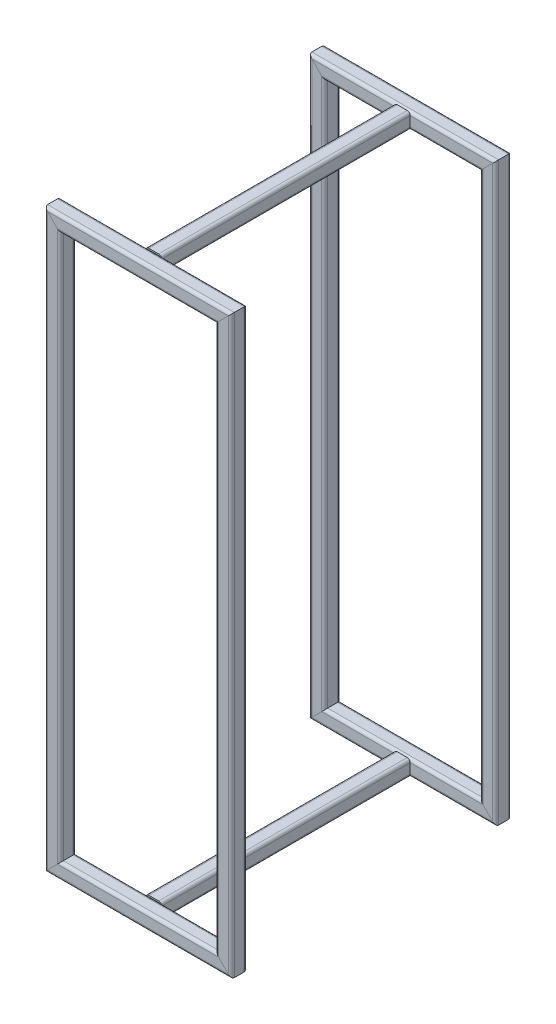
SolidWorks part; units mm, degrees
ref_plane "Front Plane" through (0, 0, 0) normal (0, 0, 1) x (1, 0, 0)
ref_plane "Top Plane" through (0, 0, 0) normal (0, 1, 0) x (1, 0, 0)
ref_plane "Right Plane" through (0, 0, 0) normal (1, 0, 0) x (0, 0, -1)
sketch3d "3DSketch2"
  line L0 (0, 0, 0) -> (0, 1800, 0) construction
  line L1 (274.6, 0, 424.6) -> (274.6, 1800, 424.6)
  line L2 (-274.6, 0, 424.6) -> (-274.6, 1800, 424.6)
  line L3 (0, 1800, -424.6) -> (0, 1800, 424.6)
  line L5 (274.6, 1800, 424.6) -> (-274.6, 1800, 424.6)
  line L7 (274.6, 1800, -424.6) -> (-274.6, 1800, -424.6)
  line L10 (0, 0, -424.6) -> (0, 0, 424.6)
  line L12 (274.6, 0, -424.6) -> (-274.6, 0, -424.6)
  line L14 (274.6, 0, 424.6) -> (-274.6, 0, 424.6)
  line L15 (274.6, 0, -424.6) -> (274.6, 1800, -424.6)
  line L16 (-274.6, 0, -424.6) -> (-274.6, 1800, -424.6)
  point P4 (0, 1800, 0)
  dimension "D1" = 1800
  dimension "D2" = 849.2
  dimension "D3" = 549.2
other "Tube square TS2X2X0.1875(1)"
ref_plane "Plane1" through (274.6, 0, 424.6) normal (0, 1, 0) x (1, 0, 0)
sketch "Sketch1" plane through (274.6, 0, 424.6) normal (0, 1, 0) x (1, 0, 0)
  line L0 (-15.875, -20.6375) -> (15.875, -20.6375)
  line L1 (-20.6375, -15.875) -> (-20.6375, 15.875)
  line L2 (15.875, 20.6375) -> (-15.875, 20.6375)
  line L3 (20.6375, 15.875) -> (20.6375, -15.875)
  line L4 (-15.875, -25.4) -> (15.875, -25.4)
  line L5 (-25.4, -15.875) -> (-25.4, 15.875)
  line L6 (15.875, 25.4) -> (-15.875, 25.4)
  line L7 (25.4, 15.875) -> (25.4, -15.875)
  line L8 (-25.4, 0) -> (-20.6375, 0) construction
  line L9 (-20.6375, 0) -> (20.6375, 0) construction
  line L10 (20.6375, 0) -> (25.4, 0) construction
  line L11 (0, 25.4) -> (0, 20.6375) construction
  line L12 (0, 20.6375) -> (0, -20.6375) construction
  line L13 (0, -20.6375) -> (0, -25.4) construction
  arc A0 (25.4, 15.875) -> (15.875, 25.4) centre (15.875, 15.875) ccw
  arc A1 (15.875, -25.4) -> (25.4, -15.875) centre (15.875, -15.875) ccw
  arc A2 (-25.4, -15.875) -> (-15.875, -25.4) centre (-15.875, -15.875) ccw
  arc A3 (-15.875, 25.4) -> (-25.4, 15.875) centre (-15.875, 15.875) ccw
  arc A4 (-15.875, 20.6375) -> (-20.6375, 15.875) centre (-15.875, 15.875) ccw
  arc A5 (20.6375, 15.875) -> (15.875, 20.6375) centre (15.875, 15.875) ccw
  arc A6 (15.875, -20.6375) -> (20.6375, -15.875) centre (15.875, -15.875) ccw
  arc A7 (-20.6375, -15.875) -> (-15.875, -20.6375) centre (-15.875, -15.875) ccw
  point P6 (-25.4, -25.4)
  point P33 (-25.4, 25.4)
  point P35 (25.4, 25.4)
  point P36 (25.4, -25.4)
  point P37 (0, 0)
  point P38 (0, 0)
  dimension "D1" = 9.525
  dimension "Thickness" = 4.7625
  dimension "V_leg" = 50.8
  dimension "H_leg" = 50.8
